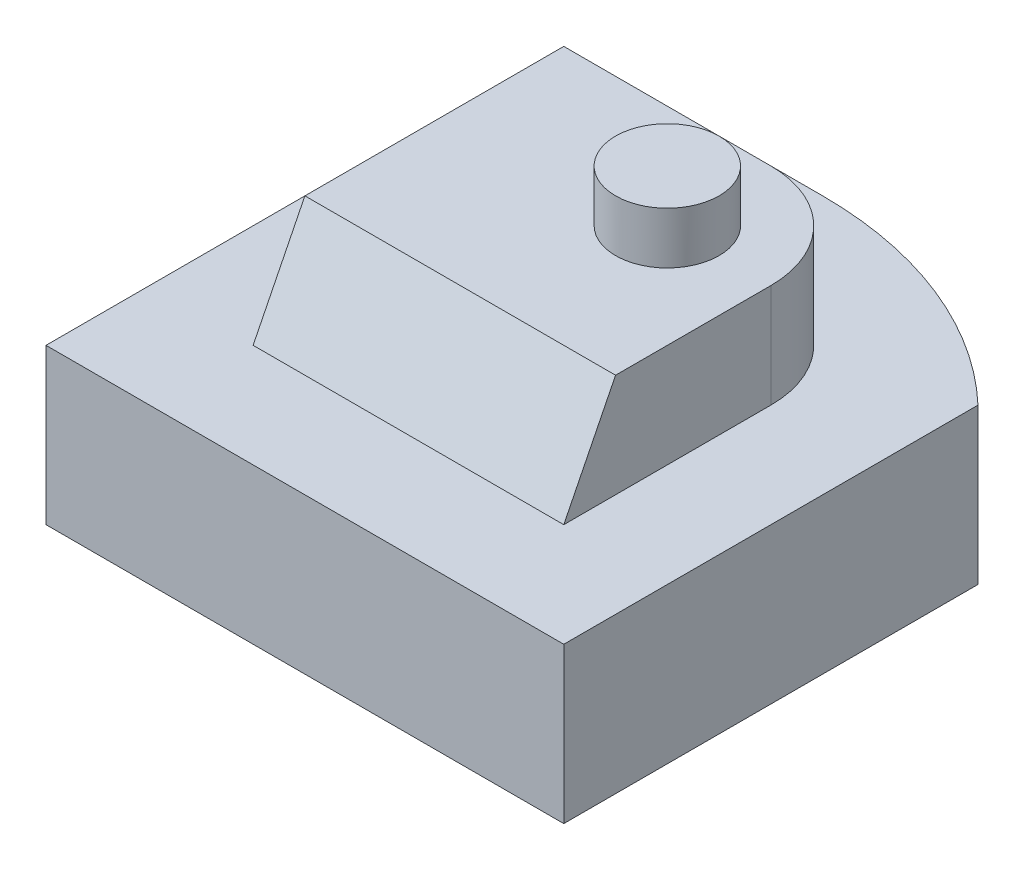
SolidWorks part; units mm, degrees
ref_plane "正面" through (0, 0, 0) normal (0, 0, 1) x (1, 0, 0)
ref_plane "平面" through (0, 0, 0) normal (0, 1, 0) x (1, 0, 0)
ref_plane "右側面" through (0, 0, 0) normal (1, 0, 0) x (0, 0, -1)
sketch "ｽｹｯﾁ1" plane through (0, 0, 0) normal (0, 1, 0) x (1, 0, 0)
  line L0 (50, 50) -> (-50, -50) construction
  line L1 (-50, -50) -> (50, -50)
  line L2 (-50, -50) -> (-50, 50)
  line L3 (-50, 50) -> (50, 50)
  line L4 (50, -50) -> (50, 50)
  dimension "D1" = 100
  dimension "D2" = 100
extrude "押し出し1" add sketch "ｽｹｯﾁ1" along normal blind 30
sketch "ｽｹｯﾁ2" plane through (0, 30, 0) normal (0, 1, 0) x (1, 0, 0)
  line L0 (30, 30) -> (-30, -30) construction
  line L1 (-30, -30) -> (30, -30)
  line L2 (-30, -30) -> (-30, 30)
  line L3 (-30, 30) -> (30, 30)
  line L4 (30, -30) -> (30, 30)
  dimension "D1" = 60
  dimension "D2" = 60
extrude "押し出し2" add sketch "ｽｹｯﾁ2" along normal blind 20
sketch "ｽｹｯﾁ3" plane through (30, 0, 0) normal (1, 0, 0) x (0, 0, -1)
  line L0 (-20, 50) -> (-30, 30)
  line L1 (-30, 50) -> (30, 50) construction
  line L2 (-30, 30) -> (-30, 50)
  line L3 (-30, 50) -> (-20, 50)
  dimension "D1" = 10
extrude "ｶｯﾄ - 押し出し1" cut sketch "ｽｹｯﾁ3" against normal through all
fillet "ﾌｨﾚｯﾄ1" radius 20 1 edges at (30, 40, -30)
sketch "ｽｹｯﾁ4" plane through (0, 50, 0) normal (0, 1, 0) x (1, 0, 0)
  circle A0 centre (10, 10) radius 10
  dimension "D1" = 20
extrude "押し出し3" add sketch "ｽｹｯﾁ4" along normal blind 10
sketch "ｽｹｯﾁ5" plane through (0, 30, 0) normal (0, 1, 0) x (1, 0, 0)
  line L0 (50, 50) -> (-50, 50) construction
  line L1 (50, -50) -> (50, 50) construction
  line L2 (50, 30) -> (50, 50)
  line L3 (50, 50) -> (0, 50)
  arc A0 (0, 50) -> (50, 30) centre (0, -22.5) cw
  dimension "D1" = 50
  dimension "D2" = 20
extrude "ｶｯﾄ - 押し出し2" cut sketch "ｽｹｯﾁ5" against normal through all
